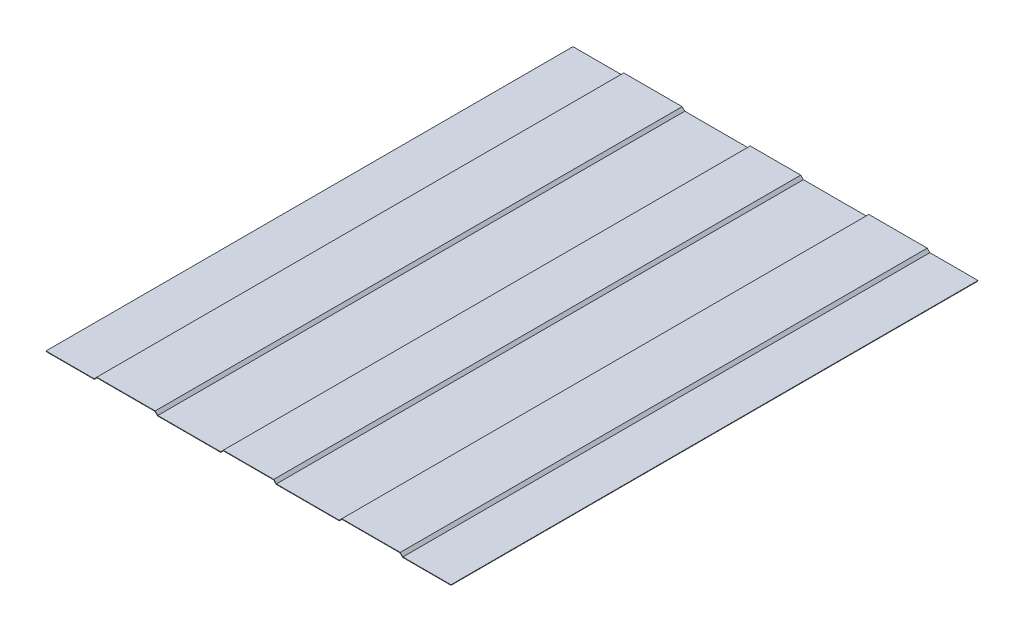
SolidWorks part; units mm, degrees
ref_plane "Plan de face" through (0, 0, 0) normal (0, 0, 1) x (1, 0, 0)
ref_plane "Plan de dessus" through (0, 0, 0) normal (0, 1, 0) x (1, 0, 0)
ref_plane "Plan de droite" through (0, 0, 0) normal (1, 0, 0) x (0, 0, -1)
sketch "Esquisse1" plane through (0, 0, 0) normal (0, 0, 1) x (1, 0, 0)
  line L0 (-384.25, 0) -> (-292.5, 0)
  line L1 (-292.5, 0) -> (-287.5, 5)
  line L2 (-287.5, 5) -> (-177.5, 5)
  line L3 (-177.5, 5) -> (-172.5, 0)
  line L4 (-172.5, 0) -> (-52.5, 0)
  line L5 (-52.5, 0) -> (-47.5, 5)
  line L6 (-47.5, 5) -> (47.5, 5)
  line L7 (0, 9.3048) -> (0, -6.1787) construction
  line L8 (292.5, 0) -> (287.5, 5)
  line L9 (384.25, 0) -> (292.5, 0)
  line L10 (287.5, 5) -> (177.5, 5)
  line L11 (177.5, 5) -> (172.5, 0)
  line L12 (172.5, 0) -> (52.5, 0)
  line L13 (52.5, 0) -> (47.5, 5)
  point P18 (0, 5)
  dimension "D1" = 384.25
  dimension "D2" = 52.5
  dimension "D3" = 120
  dimension "D4" = 120
  dimension "D5" = 5
  dimension "D6" = 5
  dimension "D7" = 135
extrude "Extru.-Mince1" add sketch "Esquisse1" along normal up to surface (1000 mm away) thin
